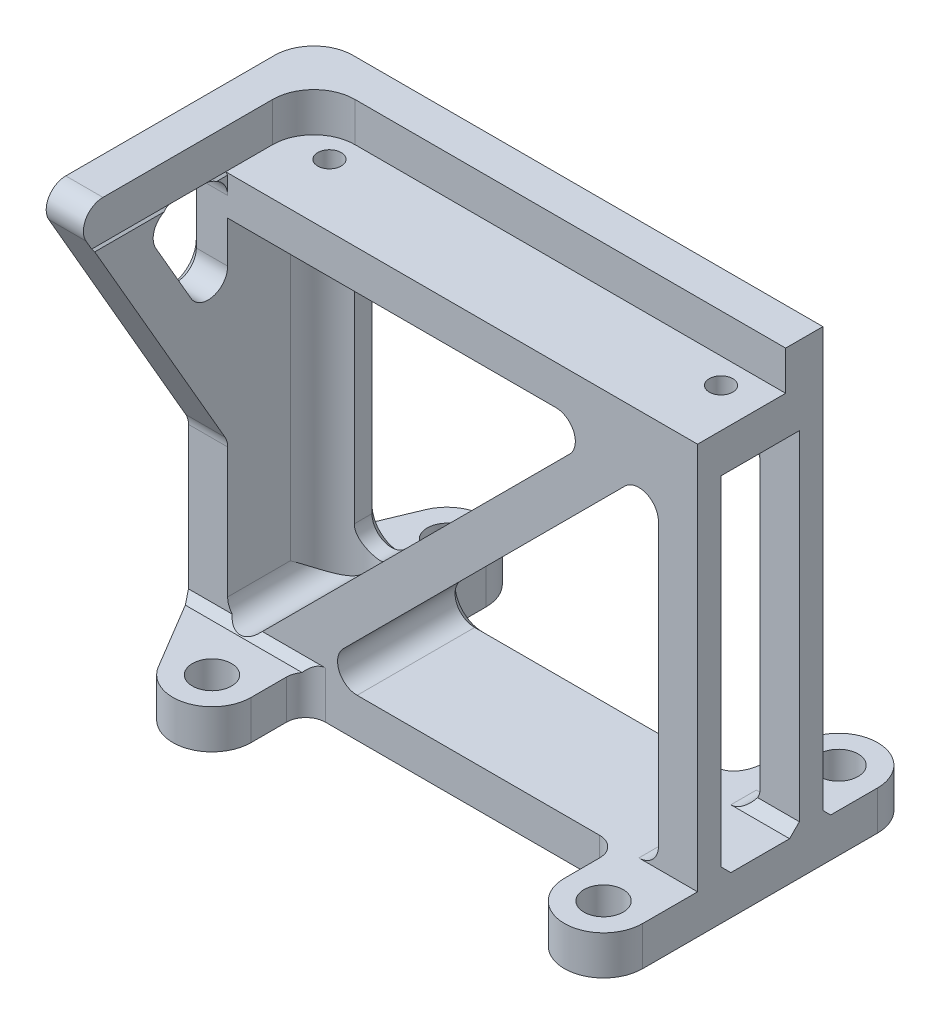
SolidWorks part; units mm, degrees
ref_plane "Ebene vorne" through (0, 0, 0) normal (0, 0, 1) x (1, 0, 0)
ref_plane "Ebene oben" through (0, 0, 0) normal (0, 1, 0) x (1, 0, 0)
ref_plane "Ebene rechts" through (0, 0, 0) normal (1, 0, 0) x (0, 0, -1)
sketch "Skizze1" plane through (0, 0, 0) normal (0, 1, 0) x (1, 0, 0)
  line L0 (-60, 0) -> (60, 0) construction
  line L1 (-60, 6) -> (60, 6)
  line L2 (-60, 6) -> (-60, -6)
  line L3 (-60, -6) -> (60, -6)
  line L4 (60, 6) -> (60, -6)
  line L5 (-60, 6) -> (60, -6) construction
  line L6 (-60, -6) -> (60, 6) construction
  line L7 (0, -6) -> (0, 6) construction
  circle A0 centre (-50, 0) radius 3
  circle A1 centre (50, 0) radius 3
  point P0 (0, 0)
  dimension "D4" = 6
  dimension "D1" = 120
  dimension "D2" = 12
  dimension "D3" = 100
extrude "Aufsatz-Linear austragen1" add sketch "Skizze1" along normal blind 10
sketch "Skizze2" plane through (0, 10, 0) normal (0, 1, 0) x (1, 0, 0)
  line L0 (-70, 6) -> (-60, 6)
  line L1 (-60, 6) -> (-60, -6)
  line L2 (-60, -6) -> (60, -6)
  line L3 (60, -6) -> (60, -16)
  line L14 (-70, 6) -> (-70, -16)
  line L15 (-70, -16) -> (60, -16)
  line L16 (-70, 6) -> (-70, -16)
  line L17 (-70, -16) -> (60, -16)
  dimension "D1" = 10
extrude "Aufsatz-Linear austragen2" add sketch "Skizze2" against normal mid plane 20
sketch "Skizze3" plane through (0, 0, -6) normal (0, 0, -1) x (-1, 0, 0)
  line L6 (-60, 0) -> (70, 0)
  line L7 (70, 0) -> (70, 20)
  line L8 (70, 20) -> (60, 20)
  line L9 (60, 20) -> (60, 10)
  line L10 (60, 10) -> (-60, 10)
  line L11 (-60, 10) -> (-60, 0)
  line L12 (-60, 0) -> (70, 0)
  line L13 (70, 0) -> (70, 20)
  line L14 (70, 20) -> (60, 20)
  line L15 (60, 20) -> (60, 10)
  line L16 (60, 10) -> (-60, 10)
  line L17 (-60, 10) -> (-60, 0)
  dimension "D1" = 0
extrude "Aufsatz-Linear austragen3" add sketch "Skizze3" along normal blind 10
fillet "Verrundung1" radius 10 1 edges at (-60, 15, 6)
ref_plane "Ebene1" through (0, -99, 0) normal (0, 1, 0) x (1, 0, 0)
fillet "Verrundung2" radius 10 1 edges at (-70, 10, 16)
sketch "Skizze5" plane through (0, 0, 0) normal (0, -1, 0) x (1, 0, 0)
  line L0 (-40, 0) -> (-40, -16)
  line L1 (60, -16) -> (-70, -16) construction
  line L2 (50, 10) -> (60, 10)
  line L3 (60, 16) -> (60, -16) construction
  line L4 (60, 10) -> (60, 16)
  line L5 (-70, -16) -> (-70, 6) construction
  line L6 (-60, 16) -> (60, 16) construction
  line L7 (-70, -16) -> (-70, 6)
  line L8 (-60, 16) -> (60, 16)
  line L9 (-70, -16) -> (-60, -16)
  line L10 (-60, -16) -> (-60, 0)
  line L11 (0, 0) -> (0, -16) construction
  line L12 (40, -16) -> (-40, -16)
  line L13 (40, 0) -> (40, -16) construction
  line L14 (40, 0) -> (60, 0) construction
  line L15 (50, -10) -> (60, -10)
  line L16 (60, -10) -> (60, -16)
  line L17 (60, -16) -> (40, -16)
  arc A0 (50, 10) -> (50, -10) centre (50, 0) ccw
  arc A1 (-40, 0) -> (-60, 0) centre (-50, 0) ccw
  arc A2 (-60, 16) -> (-70, 6) centre (-60, 6) ccw construction
  arc A3 (-60, 16) -> (-70, 6) centre (-60, 6) ccw
  dimension "D1" = 10
extrude "Aufsatz-Linear austragen4" add sketch "Skizze5" along normal up to surface (99 mm away)
sketch "Skizze6" plane through (0, 0, 16) normal (0, 0, 1) x (1, 0, 0)
  line L0 (50, 20) -> (50, 0) construction
  line L1 (-60, 20) -> (60, 20) construction
  line L2 (50, 0) -> (60, 0) construction
  line L3 (60, -89) -> (-60, -89) construction
  line L4 (60, -99) -> (60, 20) construction
  line L5 (-60, 20) -> (-60, -99) construction
  line L6 (12.1, -99) -> (-12.1, -99) construction
  line L7 (50, 0) -> (50, -89)
  line L8 (50, -89) -> (-39, -89)
  line L9 (-39, -89) -> (50, 0)
  line L10 (-53.1421, -89) -> (35.8579, 0)
  line L11 (35.8579, 0) -> (-53.1421, 0)
  line L12 (-53.1421, 0) -> (-53.1421, -89)
  dimension "D1" = 10
  dimension "D2" = 10
  dimension "D3" = 10
extrude "Schnitt-Linear austragen1" cut sketch "Skizze6" against normal through all
sketch "Skizze11" plane through (0, -99, 0) normal (0, -1, 0) x (1, 0, 0)
  line L1 (60, 10) -> (50, 10) construction
  line L3 (60, 10) -> (50, 10)
  line L4 (60, 10) -> (60, -16)
  line L5 (60, -16) -> (40, -16)
  line L6 (40, -16) -> (40, 0)
  line L8 (60, -16) -> (-40, -16) construction
  arc A0 (50, 10) -> (50, -10) centre (50, 0) ccw construction
  arc A1 (50, 10) -> (40, 0) centre (50, 0) ccw
extrude "Aufsatz-Linear austragen6" add sketch "Skizze11" against normal up to surface (10 mm away)
sketch "Skizze7" plane through (0, -99, 0) normal (0, -1, 0) x (1, 0, 0)
  line L0 (-40, -16) -> (-40, 0) construction
  line L1 (-60, 0) -> (-60, -16) construction
  line L2 (-40, -16) -> (-40, 0)
  line L3 (-60, 0) -> (-60, -16)
  line L4 (-40, -16) -> (-60, -16)
  arc A0 (-40, 0) -> (-60, 0) centre (-50, 0) ccw construction
  arc A1 (-40, 0) -> (-60, 0) centre (-50, 0) ccw
extrude "Aufsatz-Linear austragen5" add sketch "Skizze7" against normal up to surface (23.1421 mm away)
fillet "Verrundung3" radius 5 8 edges at (-53.1421, 0, 12.7468) (-53.1421, -89, 12.7468) (50, 0, 13) (50, -89, 13) (35.8579, 0, 0) (-39, -89, 0) (50, 0, -13) (50, -89, -13)
chamfer "Fase10" distance 2.5 angle 45 2 edges at (52.5, -89, -10) (52.5, -89, 10)
fillet "Verrundung5" radius 5 1 edges at (-60, -95.8579, -8)
sketch "Skizze12" plane through (0, -99, 0) normal (0, -1, 0) x (1, 0, 0)
  line L0 (50, 0) -> (-50, 0) construction
  line L1 (50, 0) -> (50, -30) construction
  line L2 (0, 0) -> (0, -16) construction
  line L3 (60, -16) -> (-70, -16) construction
  line L4 (60, -16) -> (60, -30)
  line L5 (40, -16) -> (40, -30)
  line L6 (60, -16) -> (40, -16)
  line L7 (-40, -16) -> (-40, -30)
  line L8 (-40, 16) -> (-40, 30)
  line L9 (60, 16) -> (40, 16)
  line L10 (40, 16) -> (40, 30)
  line L11 (60, 16) -> (60, 30)
  line L12 (-58.5872, -35.1245) -> (-70, -16)
  line L13 (-59.2308, 33.8462) -> (-69.2308, 9.8462)
  line L14 (-40, 16) -> (-60, 16)
  line L15 (-40, -16) -> (-70, -16)
  circle A0 centre (50, -30) radius 5
  arc A1 (60, -30) -> (50, -40) centre (50, -30) cw
  arc A2 (40, -30) -> (50, -40) centre (50, -30) ccw
  circle A3 centre (-50, -30) radius 5
  arc A4 (-40, -30) -> (-50, -40) centre (-50, -30) cw
  arc A5 (-40, 30) -> (-50, 40) centre (-50, 30) ccw
  circle A6 centre (-50, 30) radius 5
  arc A7 (40, 30) -> (50, 40) centre (50, 30) cw
  arc A8 (60, 30) -> (50, 40) centre (50, 30) ccw
  circle A9 centre (50, 30) radius 5
  arc A10 (-50, 40) -> (-59.2308, 33.8462) centre (-50, 30) ccw
  arc A11 (-60, 16) -> (-70, 6) centre (-60, 6) ccw construction
  arc A13 (-50, -40) -> (-58.5872, -35.1245) centre (-50, -30) cw
  arc A14 (-60, 16) -> (-69.2308, 9.8462) centre (-60, 6) ccw
  point P4 (0, 0)
  dimension "D3" = 10
  dimension "D1" = 100
  dimension "D2" = 30
extrude "Aufsatz-Linear austragen7" add sketch "Skizze12" against normal blind 10
sketch "Skizze13" plane through (-70, 0, 0) normal (-1, 0, 0) x (0, 0, 1)
  line L0 (-16, 20) -> (-56, 20)
  line L1 (-56, 20) -> (-16, -49.282)
  line L2 (-16, -89) -> (-16, 20) construction
  line L3 (-16, -49.282) -> (-16, 20)
  line L4 (-16, 10) -> (-38.6795, 10)
  line L5 (-38.6795, 10) -> (-16, -29.282)
  line L6 (-38.6795, 10) -> (-7.3397, -44.282) construction
  dimension "D1" = 30
  dimension "D2" = 40
  dimension "D3" = 10
extrude "Aufsatz-Linear austragen9" add sketch "Skizze13" against normal up to surface (10 mm away)
fillet "Verrundung8" radius 5 5 edges at (-65, 20, -56) (-65, -49.282, -16) (-65, -29.282, -16) (-65, 10, -16) (-65, 10, -38.6795)
chamfer "Fase2" distance 2 angle 45 18 edges at (48.5355, -87.5355, 16) (50, -48.0355, 16) (46.9134, -7.4517, 16) (5.5, -44.5, 16) (-8.6421, -44.5, 16) (28.4062, -3.0866, 16) (-12.1777, 0, 16) (-51.6777, -1.4645, 16) (-50.0556, -81.5483, 16) (-53.1421, -40.9645, 16) (-31.5483, -85.9134, 16) (6.5355, -89, 16) (-70, -15.4514, -19.7059) (-70, -2.8109, -16) (-70, 8.5355, -17.4645) (-70, 10, -25.5096) (-70, 7.5, -34.3494) (-70, -5.3109, -29.8397)
fillet "Verrundung6" radius 5 4 edges at (-40, -94, -16) (40, -94, -16) (40, -95, 16) (-40, -94, 16)
fillet "Verrundung7" radius 5 1 edges at (40, -92.5, 17.5)
chamfer "Fase9" distance 2 angle 45 4 edges at (-52.5, -89, -16) (-65.547, -89, 14.3205) (-47.5, -89, 16) (54.9495, -89, 16)
sketch "Skizze14" plane through (0, 20, 0) normal (0, 1, 0) x (1, 0, 0)
  line L0 (-60, 47.3397) -> (-60, 52.3397) construction
  line L1 (-60, 4) -> (-60, 47.3397) construction
  line L2 (60, -6) -> (-50, -6) construction
  line L3 (-60, 47.3397) -> (-60, 52.3397)
  line L4 (-60, 4) -> (-60, 47.3397)
  line L5 (60, -6) -> (-50, -6)
  line L6 (60, -6.5) -> (-50, -6.5)
  line L7 (-60.5, 4) -> (-60.5, 47.3397)
  line L8 (-60.5, 47.3397) -> (-60.5, 52.3397)
  line L9 (60, -6.5) -> (60, -6)
  line L10 (-60.5, 52.3397) -> (-60, 52.3397)
  arc A0 (-60, 4) -> (-50, -6) centre (-50, 4) ccw construction
  arc A1 (-60, 4) -> (-50, -6) centre (-50, 4) ccw
  arc A2 (-60.5, 4) -> (-50, -6.5) centre (-50, 4) ccw
  dimension "D1" = 0.5
extrude "Schnitt-Linear austragen2" cut sketch "Skizze14" against normal up to surface (10 mm away)
chamfer "Fase11" distance 0.5 angle 45 2 edges at (-60, 10, -40.1229) (-60, 10, -18.5)
ref_plane "Ebene2" through (0, 0, 66) normal (0, 0, 1) x (1, 0, 0)
mirror "Spiegeln3" about plane through (0, 0, 66) normal (0, 0, 1)
delete or keep bodies "Körper-Löschen/beibehalten 1" type delete bodies bodies 121
